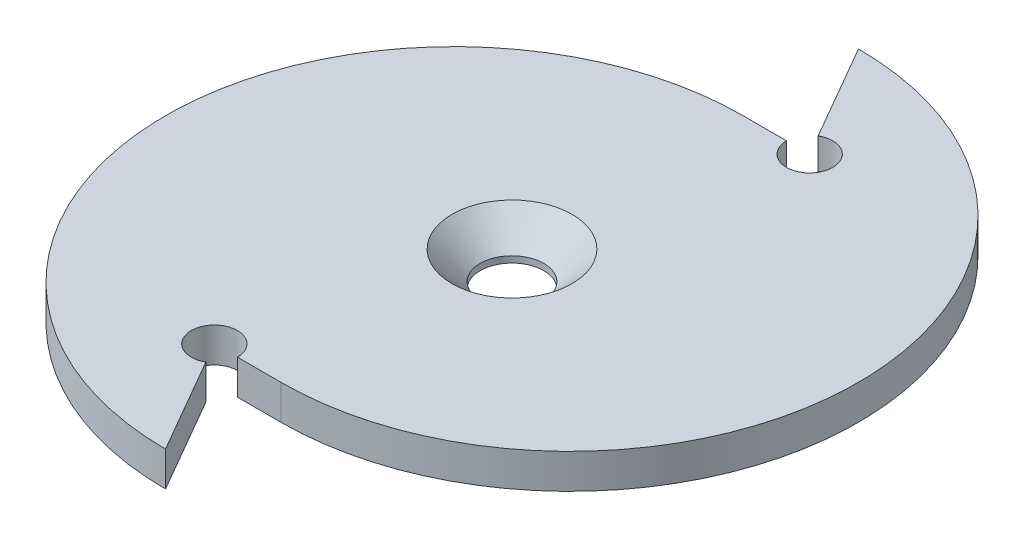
SolidWorks part; units mm, degrees
ref_plane "Front Plane" through (0, 0, 0) normal (0, 0, 1) x (1, 0, 0)
ref_plane "Top Plane" through (0, 0, 0) normal (0, 1, 0) x (1, 0, 0)
ref_plane "Right Plane" through (0, 0, 0) normal (1, 0, 0) x (0, 0, -1)
sketch "Sketch2" plane through (0, 0, 0) normal (0, 1, 0) x (1, 0, 0)
  line L0 (0, 0) -> (0, 31.7566) construction
  line L1 (0, -20) -> (-3.7735, -20)
  line L2 (0, 0) -> (0, -31.9907) construction
  line L3 (0, 20) -> (3.7735, 20)
  line L4 (0, 30) -> (4.7735, 21.7321)
  line L5 (0, -30) -> (-4.7735, -21.7321)
  arc A0 (0, -20) -> (0, 30) centre (0, 5) ccw
  arc A1 (0, 20) -> (0, -30) centre (0, -5) ccw
  arc A2 (3.7735, 20) -> (4.7735, 21.7321) centre (5.7735, 20) ccw
  arc A3 (-3.7735, -20) -> (-4.7735, -21.7321) centre (-5.7735, -20) ccw
  dimension "D3" = 50
  dimension "D6" = 4
  dimension "D1" = 5
  dimension "D2" = 5
  dimension "D4" = 60
  dimension "D5" = 60
extrude "Extrude1" add sketch "Sketch2" along normal blind 3
sketch "Sketch4" plane through (0, 3, 0) normal (0, 1, 0) x (1, 0, 0)
  point P0 (0, 0)
hole_wizard "CSK for M5 Countersunk Flat Head Screw1" positions "3DSketch2" profile "Sketch5" countersink size "M5" standard "ISO"
sketch3d "3DSketch2"
  point P0 (0, 3, 0)
sketch "Sketch5" plane through (0, 3, 0) normal (1, 0, 0) x (0, 0, 1)
  line L0 (0, 0) -> (0, 3)
  line L1 (0, 3) -> (2.75, 3)
  line L2 (2.75, 3) -> (2.75, 2.45)
  line L3 (2.75, 2.45) -> (5.2, 0)
  line L5 (5.2, 0) -> (0, 0)
  line L6 (-2.75, 2.45) -> (-5.2, 0) construction
  line L11 (0, -6.35) -> (0, 107.95) construction
  dimension "Thru Hole Dia." = 5.5
  dimension "Thru Hole Depth" = 3
  dimension "Near C'Sink Dia." = 10.4
  dimension "Near C'Sink Angle" = 90
